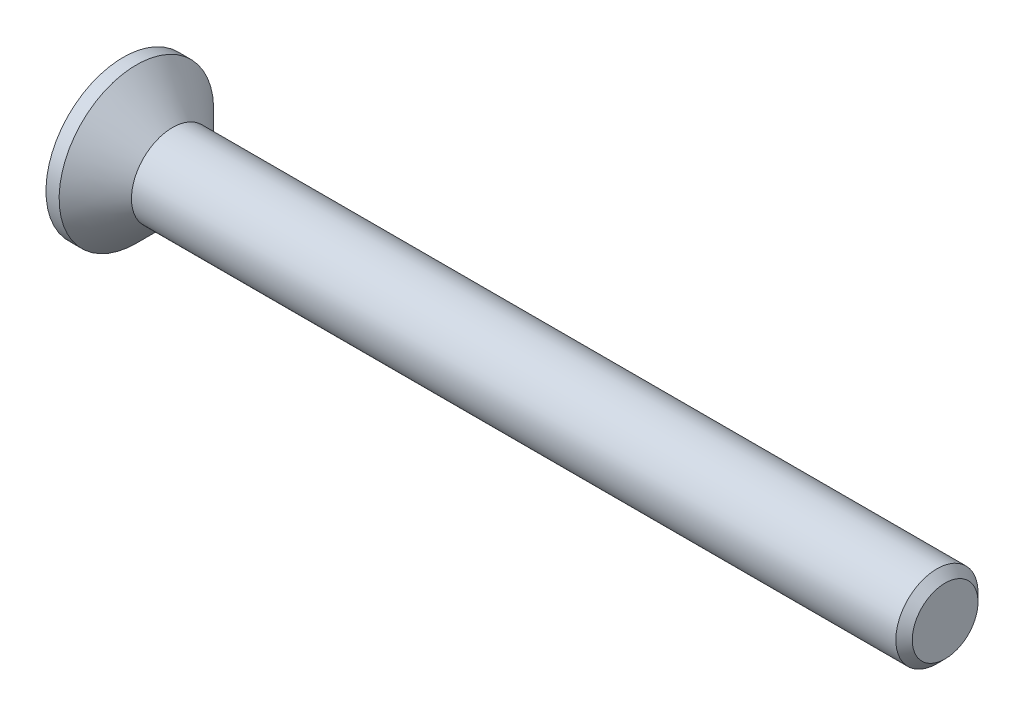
SolidWorks part; units mm, degrees
ref_plane "Front Plane" through (0, 0, 0) normal (0, 0, 1) x (1, 0, 0)
ref_plane "Top Plane" through (0, 0, 0) normal (0, 1, 0) x (1, 0, 0)
ref_plane "Right Plane" through (0, 0, 0) normal (1, 0, 0) x (0, 0, -1)
sketch "Sketch1" plane through (0, 0, 0) normal (0, 0, 1) x (1, 0, 0)
  line L1 (-1.5, 2.35) -> (-1.5, 0)
  line L2 (-1.5, 0) -> (23.5, 0)
  line L3 (23.5, 0) -> (23.5, 1.25)
  line L4 (23.5, 1.25) -> (0, 1.25)
  line L5 (-1.5, 2.35) -> (-1.1, 2.35)
  line L6 (-1.1, 2.35) -> (0, 1.25)
  dimension "D1" = 1.25
  dimension "D2" = 45
  dimension "D3" = 1.5
  dimension "D4" = 25
  dimension "D5" = 2.35
revolve "Revolve1" add sketch "Sketch1" angle 360 about L2
chamfer "Chamfer1" distance 0.25 angle 45 1 edges at (23.5, -1.25, 0)
sketch "Sketch2" plane through (-1.5, 0, 0) normal (-1, 0, 0) x (0, 0, 1)
  line L0 (-0.34, 1.35) -> (0.34, 1.35)
  line L1 (0.34, 1.35) -> (0.34, 0.34)
  line L2 (0.34, 0.34) -> (1.35, 0.34)
  line L3 (1.35, 0.34) -> (1.35, -0.34)
  line L4 (1.35, -0.34) -> (0.34, -0.34)
  line L5 (0.34, -0.34) -> (0.34, -1.35)
  line L6 (0.34, -1.35) -> (-0.34, -1.35)
  line L7 (-0.34, -1.35) -> (-0.34, -0.34)
  line L8 (-0.34, -0.34) -> (-1.35, -0.34)
  line L9 (-1.35, -0.34) -> (-1.35, 0.34)
  line L10 (-1.35, 0.34) -> (-0.34, 0.34)
  line L11 (-0.34, 0.34) -> (-0.34, 1.35)
  point P2 (0, 1.35)
  point P14 (0, -1.35)
  point P15 (1.35, 0)
  point P16 (-1.35, 0)
  dimension "D1" = 2.7
  dimension "D2" = 0.68
extrude "Cut-Extrude1" cut sketch "Sketch2" against normal blind 1.25
